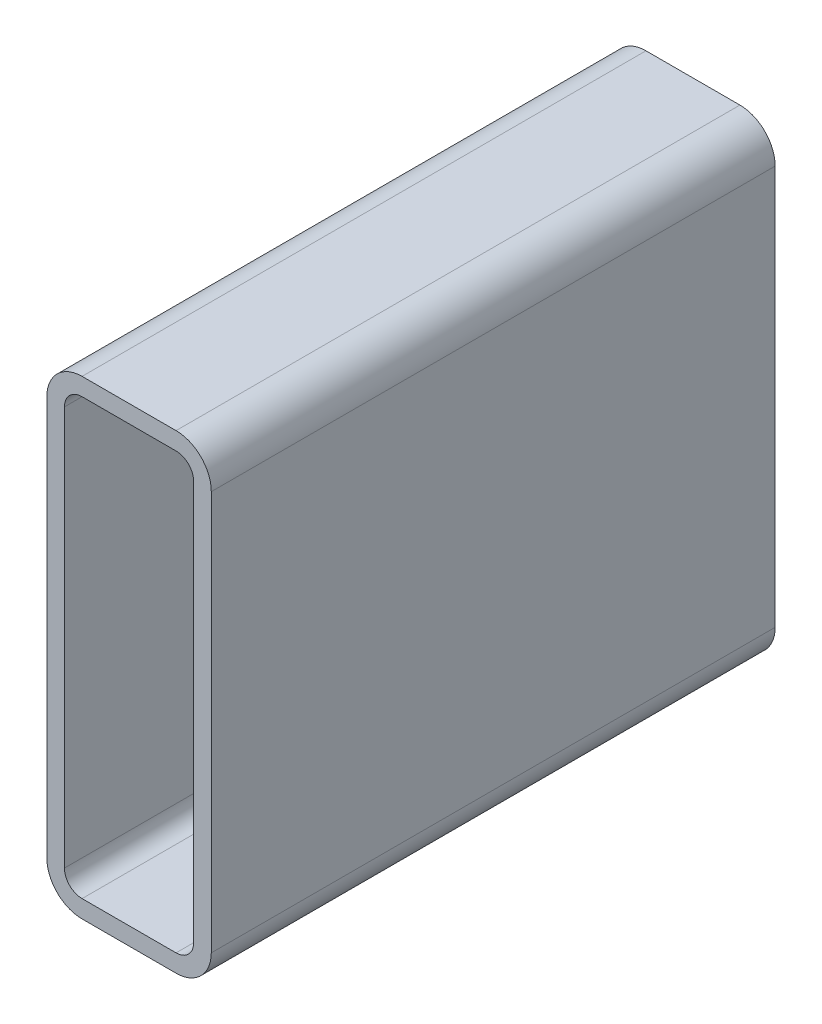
SolidWorks part; units mm, degrees
ref_plane "Front Plane" through (0, 0, 0) normal (0, 0, 1) x (1, 0, 0)
ref_plane "Top Plane" through (0, 0, 0) normal (0, 1, 0) x (1, 0, 0)
ref_plane "Right Plane" through (0, 0, 0) normal (1, 0, 0) x (0, 0, -1)
sketch "Sketch1" plane through (0, 0, 0) normal (0, 0, 1) x (1, 0, 0)
sketch_block_instance "HSS10x3.5x0.375-1"
sketch_block "HSS10x3.5x0.375"
extrude "Boss-Extrude1" add sketch "Sketch1" along normal blind 304.8
